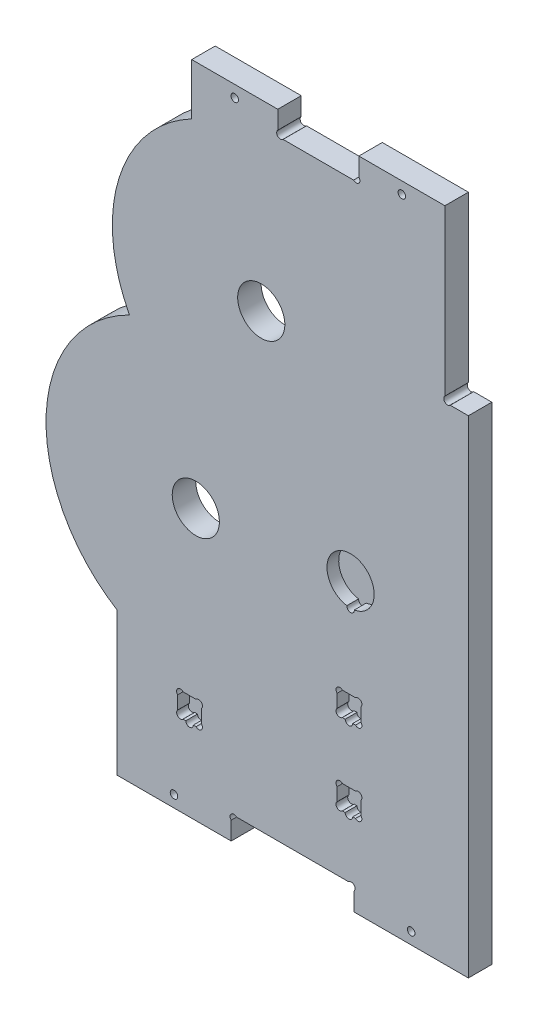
SolidWorks part; units mm, degrees
ref_plane "Plan de face" through (0, 0, 0) normal (0, 0, 1) x (1, 0, 0)
ref_plane "Plan de dessus" through (0, 0, 0) normal (0, 1, 0) x (1, 0, 0)
ref_plane "Plan de droite" through (0, 0, 0) normal (1, 0, 0) x (0, 0, -1)
sketch "Esquisse1" plane through (0, 0, 0) normal (0, 0, 1) x (1, 0, 0)
  line L0 (-20.38, 118.1071) -> (-20.38, 140)
  line L1 (-20.38, 140) -> (97.5, 140)
  line L3 (-52.3222, -140) -> (97.5, -140)
  line L4 (97.5, 140) -> (97.5, -140)
  line L5 (-97.5, 140) -> (97.5, -140) construction
  line L6 (-97.5, -140) -> (97.5, 140) construction
  line L7 (43.8207, -105.1757) -> (45.0079, -105.1757)
  line L8 (41.5579, -102.913) -> (41.5579, -97.3384)
  line L9 (43.8207, -95.0757) -> (49.3952, -95.0757)
  line L10 (51.6579, -102.913) -> (51.6579, -97.3384)
  line L11 (-24.0864, -105.2779) -> (-22.9192, -105.2779)
  line L12 (-26.3692, -103.0354) -> (-26.3692, -97.4205)
  line L13 (-24.0864, -95.1779) -> (-18.552, -95.1779)
  line L14 (-16.2692, -103.0354) -> (-16.2692, -97.4205)
  line L15 (43.8207, -70.7109) -> (45.0079, -70.7109)
  line L16 (41.5579, -68.4481) -> (41.5579, -62.8736)
  line L17 (48.2079, -105.1757) -> (49.3952, -105.1757)
  line L18 (51.6579, -68.4481) -> (51.6579, -62.8736)
  line L19 (46.6079, -60.6109) -> (46.6079, -74.8009) construction
  line L20 (51.6579, -65.6609) -> (33.5612, -65.6609) construction
  line L21 (46.6079, -95.0757) -> (46.6079, -108.5273) construction
  line L22 (51.6579, -100.1257) -> (33.5612, -100.1257) construction
  line L23 (-21.3192, -95.1779) -> (-21.3192, -108.5273) construction
  line L24 (-16.2692, -100.2279) -> (-33.5917, -100.2279) construction
  line L25 (51.668, -60.621) -> (48.0087, -64.2157) construction
  line L26 (51.668, -95.0858) -> (48.0087, -98.6806) construction
  line L27 (-52.3222, -140) -> (-52.3222, -78.9627)
  line L28 (-16.2692, -95.1779) -> (-19.8253, -98.6714) construction
  line L29 (43.8207, -60.6109) -> (49.3952, -60.6109)
  line L30 (-19.7192, -105.2779) -> (-18.552, -105.2779)
  line L31 (48.2079, -70.7109) -> (49.3952, -70.7109)
  arc A0 (48.8949, -28.4826) -> (45.7051, -28.4826) centre (47.3, -18.56) ccw
  arc A1 (-52.3222, -78.9627) -> (-46.9144, 32.4647) centre (-18.65, -24.7519) cw
  arc A2 (-46.9144, 32.4647) -> (-20.38, 118.1071) centre (9.2344, 62) cw
  arc A3 (51.6579, -62.8736) -> (49.3952, -60.6109) centre (50.5266, -61.7422) ccw
  arc A4 (41.5579, -62.8736) -> (43.8207, -60.6109) centre (42.6893, -61.7422) cw
  arc A5 (41.5579, -68.4481) -> (43.8207, -70.7109) centre (42.6893, -69.5795) ccw
  arc A6 (51.6579, -68.4481) -> (49.3952, -70.7109) centre (50.5266, -69.5795) cw
  arc A7 (49.3952, -95.0757) -> (51.6579, -97.3384) centre (50.5266, -96.2071) cw
  arc A8 (43.8207, -95.0757) -> (41.5579, -97.3384) centre (42.6893, -96.2071) ccw
  arc A9 (43.8207, -105.1757) -> (41.5579, -102.913) centre (42.6893, -104.0443) cw
  arc A10 (49.3952, -105.1757) -> (51.6579, -102.913) centre (50.5266, -104.0443) ccw
  arc A11 (-16.2692, -97.4205) -> (-18.552, -95.1779) centre (-17.4106, -96.2992) ccw
  arc A12 (-26.3692, -97.4205) -> (-24.0864, -95.1779) centre (-25.2278, -96.2992) cw
  arc A13 (-26.3692, -103.0354) -> (-24.0864, -105.2779) centre (-25.2278, -104.1567) ccw
  arc A14 (-16.2692, -103.0354) -> (-18.552, -105.2779) centre (-17.4106, -104.1567) cw
  arc A15 (45.0079, -105.1757) -> (48.2079, -105.1757) centre (46.6079, -105.1757) ccw
  arc A16 (-22.9192, -105.2779) -> (-19.7192, -105.2779) centre (-21.3192, -105.2779) ccw
  arc A17 (45.0079, -70.7109) -> (48.2079, -70.7109) centre (46.6079, -70.7109) ccw
  arc A18 (45.7051, -28.4826) -> (48.8949, -28.4826) centre (47.3, -28.61) ccw
  point P0 (0, 0)
  point P8 (-17.4106, -96.2992)
  point P18 (50.5266, -96.2071)
  point P43 (50.5266, -61.7422)
  dimension "D1" = 280
  dimension "D6" = 44.49
  dimension "D3" = 1.6
  dimension "D8" = 1.6
  dimension "D2" = 34.7221
  dimension "D7" = 1.6
extrude "Boss.-Extru.1" add sketch "Esquisse1" along normal blind 10
sketch "Esquisse2" plane through (0, 0, 0) normal (0, 0, -1) x (-1, 0, 0)
  line L0 (52.3222, -140) -> (-97.5, -140) construction
  circle A0 centre (18.65, -24.7519) radius 10.05
  dimension "D1" = 115.2481
extrude "Enlèv. mat.-Extru.1" cut sketch "Esquisse2" against normal blind 30
sketch "Esquisse5" plane through (0, 0, 0) normal (0, 0, -1) x (-1, 0, 0)
  circle A0 centre (-9.2344, 62) radius 10.05
extrude "Enlèv. mat.-Extru.3" cut sketch "Esquisse5" against normal up to next
sketch "Esquisse6" plane through (0, 0, 10) normal (0, 0, 1) x (1, 0, 0)
  line L0 (-3.5722, -125.3276) -> (-3.5722, -161.444) construction
  line L1 (97.5, -161.444) -> (97.5, -111.5165) construction
  line L2 (-52.3222, -161.444) -> (-52.3222, -132.0659) construction
  line L3 (-52.3222, -78.9627) -> (-52.3222, -140) construction
  line L4 (108.5058, -140) -> (-16.1607, -140) construction
  line L5 (-52.3222, -140) -> (97.5, -140) construction
  line L6 (48.75, -140) -> (97.5, -130) construction
  line L7 (-6.2659, -130) -> (108.5058, -130) construction
  line L8 (22.59, -151.5422) -> (22.59, -142.0553) construction
  line L9 (48.75, -161.444) -> (48.75, -124.3936) construction
  line L10 (22.7125, -156.2847) -> (-3.5722, -130) construction
  line L11 (-1.3073, -130) -> (46.4873, -130)
  line L12 (48.75, -132.2671) -> (48.75, -140)
  line L13 (48.75, -140) -> (-3.5722, -140)
  line L14 (-3.5722, -140) -> (-3.5722, -132.2649)
  circle A0 centre (73.125, -135) radius 1.6
  arc A1 (-1.3073, -130) -> (-3.5722, -132.2649) centre (-2.4397, -131.1325) ccw
  arc A2 (46.4873, -130) -> (48.75, -132.2671) centre (47.6197, -131.1325) cw
  circle A3 centre (-27.945, -135) radius 1.6
  dimension "D3" = 10
  dimension "D5" = 26.16
  dimension "D1" = 48.75
  dimension "D2" = 48.75
  dimension "D4" = 45
extrude "Enlèv. mat.-Extru.4" cut sketch "Esquisse6" against normal through all
sketch "Esquisse7" plane through (0, 0, 10) normal (0, 0, 1) x (1, 0, 0)
  line L0 (0, 130) -> (0, -145.3186) construction
  line L6 (-108.0397, 0) -> (173.2985, 0) construction
  line L8 (87.5, 140) -> (87.5, 69.7627)
  line L9 (97.5, 67.5) -> (89.7627, 67.5)
  line L10 (97.5, 140) -> (97.5, 67.5)
  line L11 (97.5, 140) -> (87.5, 140)
  line L14 (0, -130) -> (0, 145.3186) construction
  arc A1 (89.7627, 67.5) -> (87.5, 69.7627) centre (88.6314, 68.6314) cw
extrude "Enlèv. mat.-Extru.5" cut sketch "Esquisse7" against normal through all
sketch "Esquisse11" plane through (0, 0, 0) normal (0, 0, -1) x (-1, 0, 0)
  line L0 (-87.5, 140) -> (20.38, 140) construction
  line L1 (-50.82, 140) -> (-16.2784, 140)
  line L2 (-50.82, 140) -> (-50.82, 132.2627)
  line L3 (-48.5573, 130) -> (-18.5412, 130)
  line L4 (-16.2784, 140) -> (-16.2784, 132.2627)
  line L5 (-48.8936, 130) -> (-89.836, 130) construction
  line L6 (-87.5, 140) -> (-87.5, 69.7627) construction
  line L7 (-50.82, 130) -> (-43.8089, 137.0111) construction
  line L8 (-33.5492, 140) -> (-33.5492, 123.9173) construction
  line L9 (-50.82, 130) -> (-87.5, 140) construction
  arc A0 (-50.82, 132.2627) -> (-48.5573, 130) centre (-49.6886, 131.1314) ccw
  arc A1 (-16.2784, 132.2627) -> (-18.5412, 130) centre (-17.4098, 131.1314) cw
  circle A2 centre (-69.16, 135) radius 1.6
  circle A3 centre (2.0616, 135) radius 1.6
  point P10 (-49.6886, 131.1314)
  dimension "D1" = 30.0161
  dimension "D2" = 10
  dimension "D3" = 36.68
  dimension "D4" = 45
  dimension "D5" = 1.6
extrude "Enlèv. mat.-Extru.8" cut sketch "Esquisse11" against normal through all
sketch "Esquisse12" plane through (0, 0, 0) normal (0, 0, -1) x (-1, 0, 0)
  line L1 (-62.46, -6.5044) -> (-29.0251, -6.5044)
  line L2 (-62.46, -6.5044) -> (-62.46, -107.6033)
  line L3 (-62.46, -107.6033) -> (-29.0251, -107.6033)
  line L4 (-29.0251, -6.5044) -> (-29.0251, -85.4089)
  line L5 (-29.0251, -85.4089) -> (35.1824, -85.4089)
  line L7 (-29.0251, -107.6033) -> (35.1824, -107.6033)
  line L8 (35.1824, -85.4089) -> (35.1824, -107.6033)
extrude "Boss.-Extru.3" add sketch "Esquisse12" against normal blind 5
